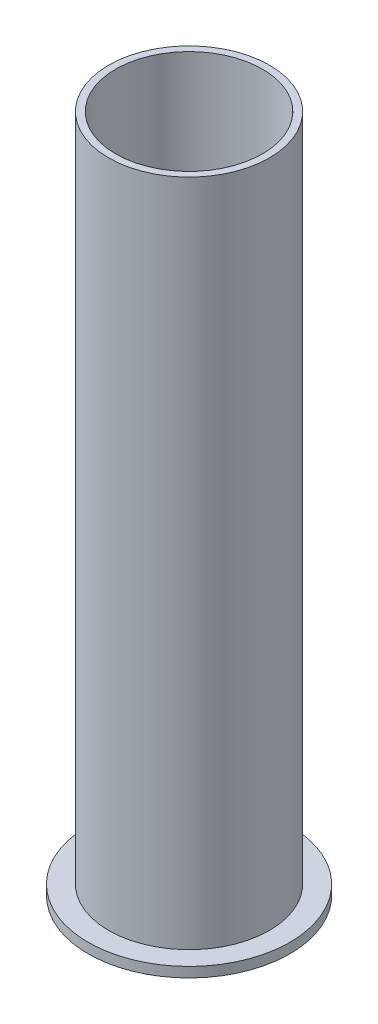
SolidWorks part; units mm, degrees
ref_plane "Front Plane" through (0, 0, 0) normal (0, 0, 1) x (1, 0, 0)
ref_plane "Top Plane" through (0, 0, 0) normal (0, 1, 0) x (1, 0, 0)
ref_plane "Right Plane" through (0, 0, 0) normal (1, 0, 0) x (0, 0, -1)
sketch "Sketch1" plane through (0, 0, 0) normal (0, 1, 0) x (1, 0, 0)
  circle A0 centre (0, 0) radius 5.7785
  circle A1 centre (0, 0) radius 6.3246
  dimension "D1" = 11.557
  dimension "D2" = 12.6492
extrude "Boss-Extrude1" add sketch "Sketch1" along normal blind 53.4416
sketch "Sketch2" plane through (0, 0, 0) normal (0, -1, 0) x (1, 0, 0)
  circle A0 centre (0, 0) radius 5.7785 construction
  circle A1 centre (0, 0) radius 5.7785
  circle A2 centre (0, 0) radius 7.9375
  dimension "D1" = 15.875
extrude "Boss-Extrude2" add sketch "Sketch2" against normal blind 0.7874
